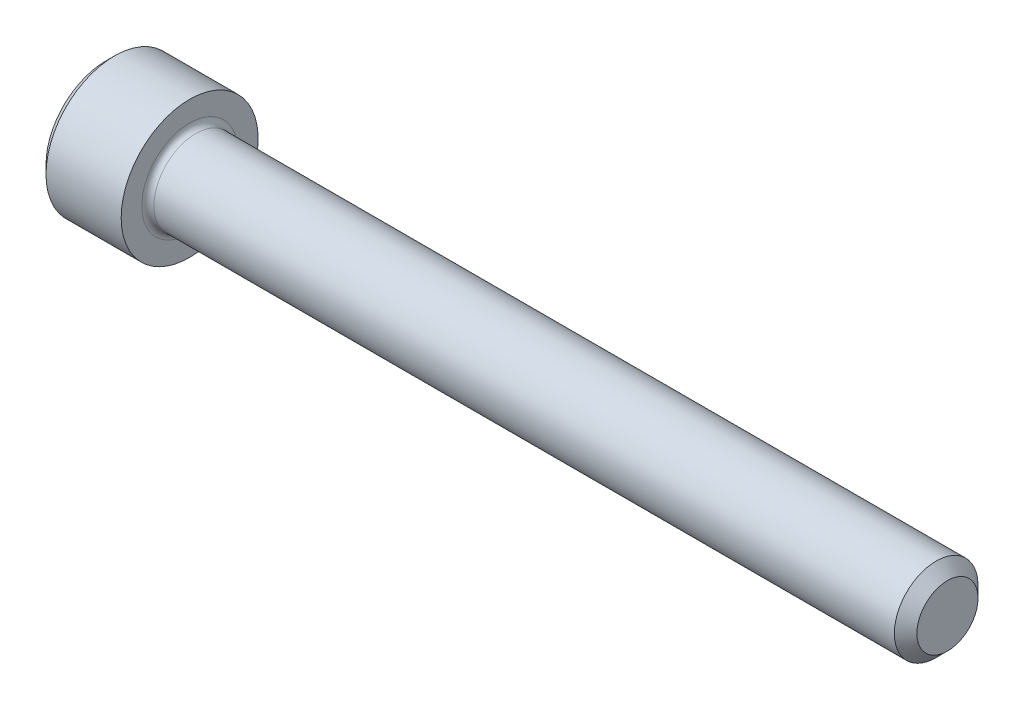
SolidWorks part; units mm, degrees
ref_plane "Plane1" through (0, 0, 0) normal (0, 0, 1) x (1, 0, 0)
ref_plane "Plane2" through (0, 0, 0) normal (0, 1, 0) x (1, 0, 0)
ref_plane "Plane3" through (0, 0, 0) normal (1, 0, 0) x (0, 0, -1)
revolve "Base-Revolve" add sketch "BodySke"
sketch "BodySke" plane through (0, 0, 0) normal (0, 0, 1) x (1, 0, 0)
  line L0 (0, 0) -> (0, 2.5146)
  line L1 (0.3556, 2.8702) -> (3.5052, 2.8702)
  line L2 (3.5052, 2.8702) -> (3.5052, 1.7526)
  line L3 (3.5052, 1.7526) -> (34.7828, 1.7526)
  line L4 (35.2552, 1.2802) -> (35.2552, 0)
  line L5 (35.2552, 0) -> (0, 0)
  line L6 (-31.75, 0) -> (127, 0) construction
  line L7 (0, 2.5146) -> (0.3556, 2.8702)
  line L8 (35.2552, 1.2802) -> (34.7828, 1.7526)
  line L9 (0, -2.5146) -> (0.3556, -2.8702) construction
  line L10 (35.2552, -1.2802) -> (34.7828, -1.7526) construction
  line L11 (4.2977, 9.525) -> (4.2977, 3.175) construction
  line L12 (16.2052, 9.525) -> (16.2052, 3.175) construction
  line L13 (-2.8448, 9.525) -> (-2.8448, 3.175) construction
  dimension "Diameter" = 3.5052
  dimension "Head_ht" = 3.5052
  dimension "Length" = 31.75
  dimension "Body_ch_ang" = 45
  dimension "Head_dia" = 5.7404
  dimension "Head_ch_ang" = 45
  dimension "Head_side_ht" = 3.1496
  dimension "Minor_dia" = 2.5603
  dimension "Advance" = 0.7925
  dimension "Thread_nom" = 19.05
  dimension "Thread_length" = 38.1
fillet "Fillet1" radius 0.254 1 edges at (3.5052, 0, 1.7526)
sketch "Sketch2" plane through (0, 0, 0) normal (0, 0, 1) x (1, 0, 0)
  line L0 (0, 1.3843) -> (1.6256, 1.3843)
  line L1 (1.6256, 1.3843) -> (2.4248, 0)
  line L2 (-31.75, 0) -> (127, 0) construction
  line L3 (2.4248, 0) -> (0, 0)
  line L4 (0, 0) -> (0, 1.3843)
  line L5 (0, 2.5146) -> (0, -2.5146) construction
  line L6 (0, 0) -> (47.625, 0) construction
  line L7 (3.5052, -2.8702) -> (3.5052, 2.8702) construction
  dimension "D1" = 1.3843
  dimension "D2" = 60
  dimension "Wall_thickness" = 1.8796
revolve "Hex-PreBroach" cut sketch "Sketch2" angle 360 about L6
sketch "Sketch3" plane through (0, 0, 0) normal (-1, 0, 0) x (0, 0.5, 0.866)
  line L0 (0.7992, 1.3843) -> (-0.7992, 1.3843)
  line L1 (-0.7992, 1.3843) -> (-1.5985, 0)
  line L2 (0.7992, 1.3843) -> (1.5985, 0)
  line L3 (0.7992, -1.3843) -> (1.5985, 0)
  line L4 (0.7992, -1.3843) -> (-0.7992, -1.3843)
  line L5 (-0.7992, -1.3843) -> (-1.5985, 0)
  dimension "D1" = 1.3843
  dimension "D2" = 1.3843
  dimension "Hex_size" = 2.7686
extrude "Hex" cut sketch "Sketch3" against normal blind 1.6256
sketch "Sketch4" plane through (0, 0, 0) normal (-1, 0, 0) x (0, 0, 1)
  line L0 (0, 0) -> (1.7399, 0)
  line L1 (0, 0) -> (6.1484, 3.5498) construction
  line L2 (0, 0) -> (0.8699, 1.5068)
  line L3 (1.4457, 0.3947) -> (1.6607, 0.5189)
  line L4 (1.0647, 1.0546) -> (1.2797, 1.1788)
  arc A0 (1.4457, 0.3947) -> (1.0647, 1.0546) centre (0, 0) ccw
  arc A1 (1.7399, 0) -> (1.6607, 0.5189) centre (0, 0) ccw
  arc A2 (0.8699, 1.5068) -> (1.2797, 1.1788) centre (0, 0) cw
  dimension "D1" = 30
  dimension "Spline_n_dim" = 2.9972
  dimension "Spline_m_dim" = 3.4798
  dimension "D2" = 60
  dimension "D3" = 0.381
  dimension "Spline_p_dim" = 0.762
extrude "Spline" [suppressed] cut sketch "Sketch4" against normal blind 1.6256
pattern_circular "CirPattern1" [suppressed] count 6 every 60
sketch "Sketch5" plane through (0, 0, 0) normal (0, 0, 1) x (1, 0, 0)
  line L0 (-31.75, 0) -> (127, 0) construction
  line L2 (0, 2.5146) -> (0, -2.5146) construction
  circle A0 centre (1.27, 0) radius 0.4445
  dimension "Drilled_hole_dia" = 0.889
  dimension "Drilled_hole_loc" = 1.27
extrude "Hole" [suppressed] cut sketch "Sketch5" against normal through all and the other way through all
pattern_circular "Drilled-4" [suppressed] count 2 every 60
pattern_circular "Drilled-6" [suppressed] count 3 every 60
sketch "ThdSchSke" plane through (0, 0, 0) normal (0, 0, 1) x (1, 0, 0)
  line L0 (16.2052, -1.2802) -> (15.8744, -1.7526)
  line L1 (16.2052, -1.2802) -> (16.536, -1.7526)
  line L2 (16.536, -1.7526) -> (16.536, -2.1908)
  line L3 (-3.175, 0) -> (5.1513, 0) construction
  line L5 (16.536, -2.1908) -> (15.8744, -2.1908)
  line L6 (15.8744, -2.1908) -> (15.8744, -1.7526)
  line L7 (0, 2.5146) -> (0, -2.5146) construction
  dimension "Thread_minor" = 2.5603
  dimension "Diameter" = 3.5052
  dimension "Start" = 16.2052
  dimension "SideAngle" = 55
  dimension "VeeAngle" = 70
  dimension "Overcut" = 4.3815
revolve "ThreadSchematic" [suppressed] cut sketch "ThdSchSke" angle 360 about L3
pattern_linear "ThdSchPat" [suppressed]
equation "\"D2@Sketch3\" = \"Hex_size@Sketch3\" / 2"
equation "\"D1@Sketch3\" = \"Hex_size@Sketch3\" / 2"
equation "\"D1@Sketch2\" = \"Hex_size@Sketch3\" / 2"
equation "\"D3@Sketch4\" = \"Spline_p_dim@Sketch4\" / 2"
equation "\"Thread_minor@ThreadCosmetic\"  =  \"Minor_dia@BodySke\""
equation "\"D2@CirPattern1\" = 360 / \"Num_teeth@CirPattern1\""
equation "\"Wall_thickness@Sketch2\" = \"Head_ht@BodySke\" - \"Key_eng@Hex\""
equation "\"Thread_length@ThreadCosmetic\" = ((sgn( (\"Length@BodySke\" - \"Advance@BodySke\" ) - \"Thread_nom@BodySke\" )-1)*( (\"Length@BodySke\" - \"Advance@BodySke\" ) - \"Thread_nom@BodySke\" ))/-2+ \"Thread_nom@BodySke\""
equation "\"Thread_minor@ThdSchSke\" = \"Minor_dia@BodySke\""
equation "\"Diameter@ThdSchSke\" = \"Diameter@BodySke\""
equation "\"Overcut@ThdSchSke\" = \"Diameter@BodySke\" * 1.25"
equation "\"Start@ThdSchSke\" = \"Head_ht@BodySke\" + \"Length@BodySke\" - \"Thread_length@ThreadCosmetic\"  '---Non-countersunk---"
equation "\"Num_threads@ThdSchPat\" = int( \"Thread_length@ThreadCosmetic\" / \"Advance@BodySke\" + 0.999 )  + 1"
equation "\"Advance@ThdSchPat\" = \"Thread_length@ThreadCosmetic\" /  (\"Num_threads@ThdSchPat\" - 1) 'relax it"
equation "\"Num_threads@ThdSchPat\" = \"Num_threads@ThdSchPat\" - sgn( \"Num_threads@ThdSchPat\" - 1) '---chamfered tips only---"
